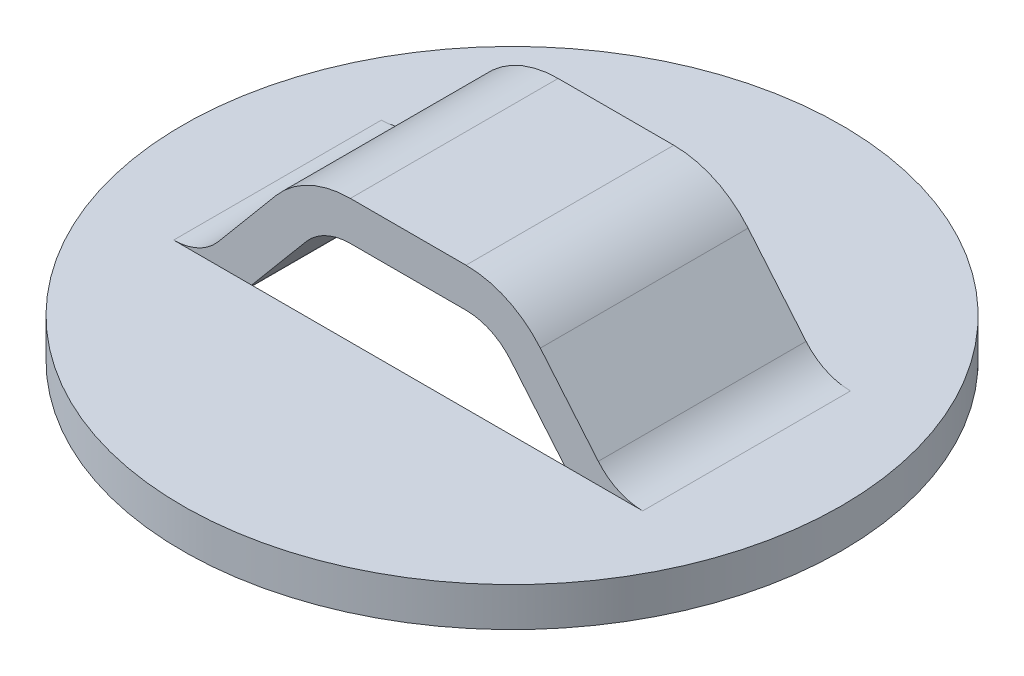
SolidWorks part; units mm, degrees
other "Boss-Extrude1"
ref_plane "Front Plane" through (0, 0, 0) normal (0, 0, 1) x (1, 0, 0)
ref_plane "Top Plane" through (0, 0, 0) normal (0, 1, 0) x (1, 0, 0)
ref_plane "Right Plane" through (0, 0, 0) normal (1, 0, 0) x (0, 0, -1)
imported_body "Imported1"
sketch "Sketch1" plane through (0, -1.8796, 0) normal (0, -1, 0) x (1, 0, 0)
  line L0 (0, 0) -> (0, -10.0076) construction
  line L1 (2.7857, -10.0076) -> (-2.7857, -10.0076) construction
  line L3 (-11.2978, -10.0076) -> (11.2978, -10.0076)
  line L4 (-11.2978, -10.0076) -> (-11.2978, 0)
  line L5 (-11.2978, 0) -> (11.2978, 0)
  line L6 (11.2978, -10.0076) -> (11.2978, 0)
  line L7 (-11.2978, -10.0076) -> (11.2978, 0) construction
  line L8 (-11.2978, 0) -> (11.2978, -10.0076) construction
  circle A0 centre (0, -5.0038) radius 15.875
extrude "Boss-Extrude1" add sketch "Sketch1" against normal up to vertex
other "DeleteFace1"
